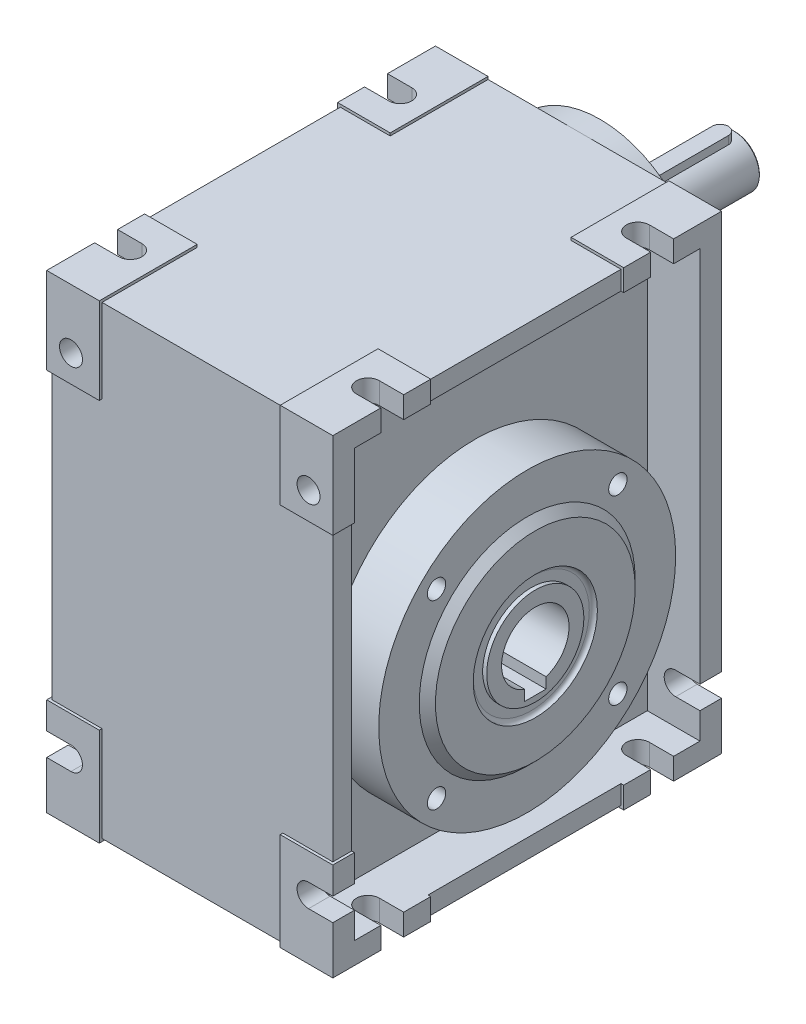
SolidWorks part; units mm, degrees
ref_plane "前视基准面" through (0, 0, 0) normal (0, 0, 1) x (1, 0, 0)
ref_plane "上视基准面" through (0, 0, 0) normal (0, 1, 0) x (1, 0, 0)
ref_plane "右视基准面" through (0, 0, 0) normal (1, 0, 0) x (0, 0, -1)
sketch "草图1" plane through (0, 0, 0) normal (1, 0, 0) x (0, 0, -1)
  line L2 (-72, 102) -> (-72, -72)
  line L3 (-72, -72) -> (72, -72)
  line L4 (72, -72) -> (72, 102)
  line L5 (72, 102) -> (-72, 102)
extrude "凸台-拉伸1" add sketch "草图1" along normal blind 106
sketch "草图2" plane through (106, 0, 0) normal (1, 0, 0) x (0, 0, -1)
  line L4 (-64, -64) -> (64, -64)
  line L5 (-64, -64) -> (-64, 94)
  line L6 (-64, 94) -> (64, 94)
  line L7 (64, -64) -> (64, 94)
  line L8 (-64, -64) -> (64, 94) construction
  line L9 (-64, 94) -> (64, -64) construction
  point P6 (0, 15)
extrude "切除-拉伸1" cut sketch "草图2" against normal blind 14
sketch "草图3" plane through (0, 0, 0) normal (-1, 0, 0) x (0, 0, 1)
  line L4 (-64, -64) -> (64, -64)
  line L5 (-64, -64) -> (-64, 94)
  line L6 (-64, 94) -> (64, 94)
  line L7 (64, -64) -> (64, 94)
  line L8 (-64, -64) -> (64, 94) construction
  line L9 (-64, 94) -> (64, -64) construction
  point P6 (0, 15)
extrude "切除-拉伸2" cut sketch "草图3" against normal blind 14
sketch "草图4" plane through (0, 102, 0) normal (0, 1, 0) x (1, 0, 0)
  line L1 (106, 72) -> (106, -72) construction
  line L3 (97, -45.75) -> (106, -45.75)
  line L5 (97, 54.25) -> (106, 54.25)
  line L6 (106, 54.25) -> (106, 45.75)
  line L9 (9, 45.75) -> (0, 45.75)
  line L10 (0, 45.75) -> (0, 54.25)
  line L11 (0, 72) -> (0, -72) construction
  line L12 (0, 54.25) -> (9, 54.25)
  line L13 (9, -54.25) -> (0, -54.25)
  line L14 (0, -54.25) -> (0, -45.75)
  line L15 (0, -45.75) -> (9, -45.75)
  line L17 (106, -45.75) -> (106, -54.25)
  line L18 (106, -54.25) -> (97, -54.25)
  line L19 (106, 45.75) -> (97, 45.75)
  arc A0 (9, 45.75) -> (9, 54.25) centre (9, 50) ccw
  arc A1 (9, -54.25) -> (9, -45.75) centre (9, -50) ccw
  arc A2 (97, -45.75) -> (97, -54.25) centre (97, -50) ccw
  arc A3 (97, 54.25) -> (97, 45.75) centre (97, 50) ccw
  point P5 (53, 0)
extrude "切除-拉伸3" cut sketch "草图4" against normal blind 174
sketch "草图5" plane through (0, 0, 72) normal (0, 0, 1) x (1, 0, 0)
  line L0 (9, -45.75) -> (0, -45.75)
  line L1 (0, 102) -> (0, -72) construction
  line L2 (0, 0) -> (0, -50)
  line L4 (0, -45.75) -> (0, -54.25)
  line L5 (0, -54.25) -> (9, -54.25)
  line L6 (97, -54.25) -> (106, -54.25)
  line L7 (106, 102) -> (106, -72) construction
  line L8 (106, -54.25) -> (106, -45.75)
  line L10 (97, -45.75) -> (106, -45.75)
  arc A0 (9, -54.25) -> (9, -45.75) centre (9, -50) ccw
  arc A1 (97, -45.75) -> (97, -54.25) centre (97, -50) ccw
extrude "切除-拉伸4" cut sketch "草图5" against normal blind 144 contours L10 A1 L6 M3 | L5 A0 L0 M1
sketch "草图6" plane through (0, 0, 72) normal (0, 0, 1) x (1, 0, 0)
  circle A0 centre (9, 80) radius 4.25
  circle A1 centre (97, 80) radius 4.25
extrude "切除-拉伸5" cut sketch "草图6" against normal blind 8
sketch "草图7" plane through (0, 102, 0) normal (0, 1, 0) x (1, 0, 0)
  line L0 (106, 35.75) -> (105, 35.75)
  line L1 (0, 45.75) -> (0, -45.75) construction
  line L2 (106, 45.75) -> (106, -45.75) construction
  line L3 (0, 35.75) -> (0, -35.75)
  line L4 (0, -35.75) -> (1, -35.75)
  line L5 (1, -35.75) -> (1, 35.75)
  line L6 (1, 35.75) -> (0, 35.75)
  line L7 (105, 35.75) -> (105, -35.75)
  line L8 (105, -35.75) -> (106, -35.75)
  line L9 (106, -35.75) -> (106, 35.75)
extrude "切除-拉伸6" cut sketch "草图7" against normal blind 174
sketch "草图8" plane through (0, 0, 72) normal (0, 0, 1) x (1, 0, 0)
  line L1 (106, -72) -> (0, -72) construction
  line L2 (19.5, -72) -> (19.5, -71)
  line L3 (19.5, -71) -> (86.5, -71)
  line L4 (86.5, -71) -> (86.5, -72)
  line L5 (86.5, -72) -> (19.5, -72)
extrude "切除-拉伸7" cut sketch "草图8" against normal blind 144
sketch "草图9" plane through (106, 0, 0) normal (1, 0, 0) x (0, 0, -1)
  line L0 (-72, -45.75) -> (-72, -35.75)
  line L1 (-72, 102) -> (-72, -45.75) construction
sketch "草图10" plane through (105, 0, 0) normal (1, 0, 0) x (0, 0, -1)
  line L0 (-35.75, 102) -> (35.75, 102)
  line L1 (35.75, 102) -> (35.75, 101)
  line L4 (35.75, 94) -> (35.75, 102) construction
  line L5 (35.75, 101) -> (-35.75, 101)
  line L6 (-35.75, 94) -> (-35.75, 102) construction
  line L7 (-35.75, 101) -> (-35.75, 102)
  line L8 (-35.75, -72) -> (35.75, -72)
  line L9 (35.75, -72) -> (35.75, -71)
  line L10 (35.75, -72) -> (35.75, -64) construction
  line L11 (35.75, -71) -> (-35.75, -71)
  line L12 (-35.75, -71) -> (-35.75, -72)
extrude "切除-拉伸8" cut sketch "草图10" against normal blind 144
sketch "草图11" plane through (0, 0, 72) normal (0, 0, 1) x (1, 0, 0)
  line L1 (106, 102) -> (0, 102) construction
  line L2 (19.5, 102) -> (19.5, 101)
  line L3 (19.5, 101) -> (86.5, 101)
  line L4 (86.5, 101) -> (86.5, 102)
  line L5 (86.5, 102) -> (19.5, 102)
extrude "切除-拉伸9" cut sketch "草图11" against normal blind 144
sketch "草图12" plane through (0, 101, 0) normal (0, 1, 0) x (1, 0, 0)
  line L0 (19.5, -72) -> (86.5, -72) construction
  line L1 (19.5, -73) -> (86.5, -73)
  line L2 (19.5, -73) -> (19.5, -71)
  line L3 (19.5, -71) -> (86.5, -71)
  line L4 (86.5, -73) -> (86.5, -71)
  line L5 (19.5, -73) -> (86.5, -71) construction
  line L6 (19.5, -71) -> (86.5, -73) construction
  line L7 (86.5, -35.75) -> (86.5, -72) construction
  point P0 (53, -72)
extrude "切除-拉伸10" cut sketch "草图12" against normal blind 174
sketch "草图13" plane through (0, 0, 0) normal (-1, 0, 0) x (0, 0, 1)
  line L1 (72, 102) -> (72, -45.75) construction
  line L3 (72, 70) -> (72, -35.75)
  line L4 (72, -35.75) -> (71, -35.75)
  line L5 (71, -35.75) -> (71, 70)
  line L6 (71, 70) -> (72, 70)
extrude "切除-拉伸11" cut sketch "草图13" against normal blind 106
sketch "草图14" plane through (0, 0, 71) normal (0, 0, 1) x (1, 0, 0)
  line L0 (0, 70) -> (0, -35.75)
  line L1 (0, -35.75) -> (1, -35.75)
  line L4 (19.5, -35.75) -> (0, -35.75) construction
  line L5 (1, -35.75) -> (1, 70)
  line L6 (19.5, 70) -> (0, 70) construction
  line L7 (1, 70) -> (0, 70)
  line L8 (106, 70) -> (106, -35.75)
  line L9 (106, -35.75) -> (105, -35.75)
  line L10 (106, -35.75) -> (86.5, -35.75) construction
  line L11 (105, -35.75) -> (105, 70)
  line L12 (106, 70) -> (86.5, 70) construction
  line L13 (105, 70) -> (106, 70)
extrude "切除-拉伸12" cut sketch "草图14" against normal blind 8
sketch "草图15" plane through (0, 0, -72) normal (0, 0, -1) x (-1, 0, 0)
  circle A0 centre (-53, 63) radius 38
extrude "凸台-拉伸2" add sketch "草图15" along normal blind 8
ref_plane "基准面1" through (0, 0, -83) normal (0, 0, 1) x (1, 0, 0)
sketch "草图21" plane through (92, 0, 0) normal (1, 0, 0) x (0, 0, -1)
  circle A0 centre (0, 0) radius 55
extrude "凸台-拉伸6" add sketch "草图21" along normal blind 14
sketch "草图22" plane through (106, 0, 0) normal (1, 0, 0) x (0, 0, -1)
  point P1 (-33.5876, 33.5876)
  point P3 (33.5876, 33.5876)
  point P4 (33.5876, -33.5876)
  point P5 (-33.5876, -33.5876)
hole_wizard "M8 螺纹孔1" positions "3D草图1" profile "草图23" tap size "M8" standard "GB"
sketch3d "3D草图1"
  point P0 (106, 33.5876, 33.5876)
  point P3 (106, 33.5876, -33.5876)
  point P6 (106, -33.5876, -33.5876)
  point P9 (106, -33.5876, 33.5876)
sketch "草图23" plane through (106, 33.5876, 33.5876) normal (0, 1, 0) x (0, 0, -1)
  line L0 (0, 0) -> (0, 24.2929)
  line L1 (0, 24.2929) -> (3.4, 22.25)
  line L2 (3.4, 22.25) -> (3.4, 0)
  line L5 (3.4, 0) -> (0, 0)
  line L10 (0, 24.2929) -> (-3.4, 22.25) construction
  line L11 (0, -6.35) -> (0, 107.95) construction
  dimension "螺纹孔钻头直径" = 6.8
  dimension "螺纹孔钻头深度" = 22.25
  dimension "导头角度" = 118
sketch "草图24" plane through (106, 0, 0) normal (1, 0, 0) x (0, 0, -1)
  circle A0 centre (0, 0) radius 40
extrude "凸台-拉伸7" add sketch "草图24" along normal blind 3
chamfer "倒角1" distance 3 angle 45 1 edges at (109, 0, -40)
sketch "草图25" plane through (109, 0, 0) normal (1, 0, 0) x (0, 0, -1)
  circle A0 centre (0, 0) radius 23
  circle A1 centre (0, 0) radius 18
extrude "切除-拉伸14" cut sketch "草图25" against normal blind 1.5
fillet "圆角2" radius 1.5 1 edges at (107.5, 0, -23)
sketch "草图26" plane through (14, 0, 0) normal (-1, 0, 0) x (0, 0, 1)
  circle A0 centre (0, 0) radius 55
extrude "凸台-拉伸8" add sketch "草图26" along normal blind 14
sketch "草图27" plane through (0, 0, 0) normal (-1, 0, 0) x (0, 0, 1)
  point P12 (-33.5876, 33.5876)
  point P13 (-33.5876, -33.5876)
  point P14 (33.5876, -33.5876)
  point P15 (33.5876, 33.5876)
hole_wizard "M8 螺纹孔2" positions "3D草图2" profile "草图28" tap size "M8" standard "GB"
sketch3d "3D草图2"
  point P0 (0, 33.5876, -33.5876)
  point P3 (0, -33.5876, -33.5876)
  point P6 (0, -33.5876, 33.5876)
  point P9 (0, 33.5876, 33.5876)
sketch "草图28" plane through (0, 33.5876, -33.5876) normal (0, 1, 0) x (0, 0, 1)
  line L0 (0, 0) -> (0, 24.2929)
  line L1 (0, 24.2929) -> (3.4, 22.25)
  line L2 (3.4, 22.25) -> (3.4, 0)
  line L5 (3.4, 0) -> (0, 0)
  line L10 (0, 24.2929) -> (-3.4, 22.25) construction
  line L11 (0, -6.35) -> (0, 107.95) construction
  dimension "螺纹孔钻头直径" = 6.8
  dimension "螺纹孔钻头深度" = 22.25
  dimension "导头角度" = 118
sketch "草图29" plane through (0, 0, 0) normal (-1, 0, 0) x (0, 0, 1)
  circle A0 centre (0, 0) radius 40
extrude "凸台-拉伸9" add sketch "草图29" along normal blind 3
chamfer "倒角2" distance 3 angle 45 1 edges at (-3, 0, 40)
sketch "草图30" plane through (-3, 0, 0) normal (-1, 0, 0) x (0, 0, 1)
  circle A0 centre (0, 0) radius 23
  circle A1 centre (0, 0) radius 18
extrude "切除-拉伸15" cut sketch "草图30" against normal blind 1.5
fillet "圆角3" radius 1.5 1 edges at (-1.5, 0, 23)
sketch "草图33" plane through (109, 0, 0) normal (1, 0, 0) x (0, 0, -1)
  line L2 (-4, -15.8) -> (-4, -11.8427)
  line L4 (4, -11.8427) -> (4, -15.8)
  line L5 (4, -15.8) -> (-4, -15.8)
  arc A0 (4, -11.8427) -> (-4, -11.8427) centre (0, 0) ccw
extrude "切除-拉伸16" cut sketch "草图33" against normal blind 112
sketch "草图38" plane through (14, 0, 0) normal (-1, 0, 0) x (0, 0, 1)
  line L0 (-64, 94) -> (64, 94)
  line L1 (64, 94) -> (64, -64)
  line L2 (64, -64) -> (-64, -64)
  line L3 (-64, -64) -> (-64, 94)
  circle A0 centre (0, 0) radius 55
extrude "切除-拉伸19" cut sketch "草图38" against normal blind 5.5
sketch "草图39" plane through (92, 0, 0) normal (1, 0, 0) x (0, 0, -1)
  line L0 (-64, 94) -> (64, 94)
  line L1 (64, 94) -> (64, -64)
  line L2 (64, -64) -> (-64, -64)
  line L3 (-64, -64) -> (-64, 94)
  circle A0 centre (0, 0) radius 55
extrude "切除-拉伸20" cut sketch "草图39" against normal blind 5.5
sketch "草图41" plane through (0, 0, -80) normal (0, 0, -1) x (-1, 0, 0)
  circle A0 centre (-53, 63) radius 11
extrude "凸台-拉伸10" add sketch "草图41" along normal blind 10
sketch "草图42" plane through (0, 0, -90) normal (0, 0, -1) x (-1, 0, 0)
  circle A0 centre (-53, 63) radius 9.5
extrude "凸台-拉伸11" add sketch "草图42" along normal blind 40
ref_plane "基准面2" through (0, 72.5, 0) normal (0, 1, 0) x (1, 0, 0)
sketch "草图44" plane through (0, 72.5, 0) normal (0, 1, 0) x (1, 0, 0)
  line L3 (50, 95.5) -> (50, 124.5)
  line L5 (56, 124.5) -> (56, 95.5)
  arc A0 (56, 124.5) -> (50, 124.5) centre (53, 124.5) ccw
  arc A1 (50, 95.5) -> (56, 95.5) centre (53, 95.5) ccw
extrude "切除-拉伸21" cut sketch "草图44" against normal blind 3.5
sketch "草图45" plane through (0, 69, 0) normal (0, 1, 0) x (1, 0, 0)
  line L0 (50, 95.5) -> (50, 124.5)
  line L2 (56, 124.5) -> (56, 95.5)
  arc A0 (56, 124.5) -> (50, 124.5) centre (53, 124.5) ccw
  arc A1 (50, 95.5) -> (56, 95.5) centre (53, 95.5) ccw
extrude "凸台-拉伸12" add sketch "草图45" along normal blind 6 separate body
chamfer "倒角3" distance 0.5 angle 45 1 edges at (43.5, 63, -130)
